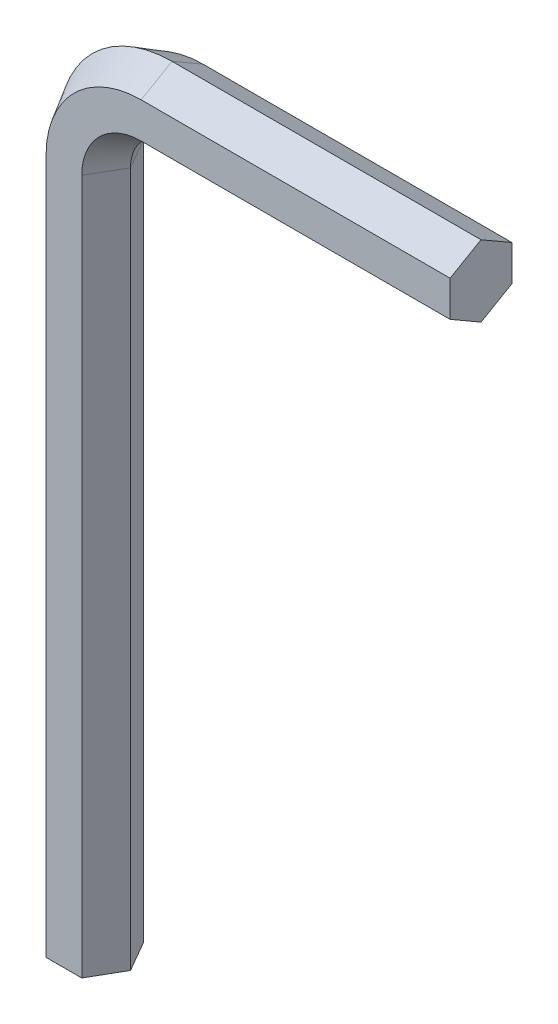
SolidWorks part; units mm, degrees
ref_plane "Front Plane" through (0, 0, 0) normal (0, 0, 1) x (1, 0, 0)
ref_plane "Top Plane" through (0, 0, 0) normal (0, 1, 0) x (1, 0, 0)
ref_plane "Right Plane" through (0, 0, 0) normal (1, 0, 0) x (0, 0, -1)
sketch "Sketch1" plane through (0, 0, 0) normal (0, 0, 1) x (1, 0, 0)
  line L0 (0, 0) -> (0, 45)
  line L1 (5, 50) -> (25, 50)
  arc A0 (0, 45) -> (5, 50) centre (5, 45) cw
  point P6 (0, 50)
  dimension "D3" = 5
  dimension "D1" = 50
  dimension "D2" = 25
sketch "Sketch2" plane through (0, 0, 0) normal (0, 1, 0) x (1, 0, 0)
  line L1 (-2.3094, 0) -> (-1.1547, -2)
  line L2 (-1.1547, -2) -> (1.1547, -2)
  line L3 (1.1547, -2) -> (2.3094, 0)
  line L4 (2.3094, 0) -> (1.1547, 2)
  line L5 (1.1547, 2) -> (-1.1547, 2)
  line L6 (-1.1547, 2) -> (-2.3094, 0)
  circle A0 centre (0, 0) radius 2 construction
  dimension "D1" = 4
sweep "Sweep1" add profiles "Sketch2" path "Sketch1"
